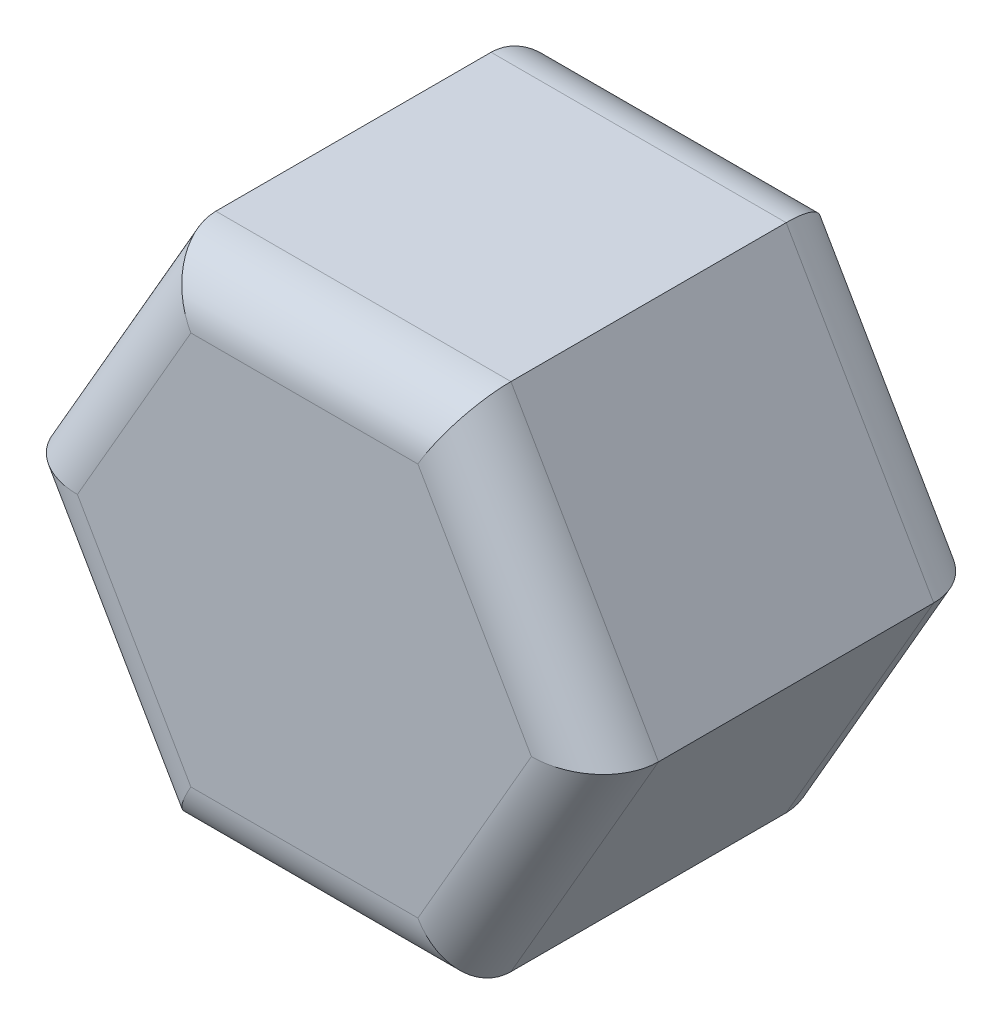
SolidWorks part; units mm, degrees
ref_plane "Спереди" through (0, 0, 0) normal (0, 0, 1) x (1, 0, 0)
ref_plane "Сверху" through (0, 0, 0) normal (0, 1, 0) x (1, 0, 0)
ref_plane "Справа" through (0, 0, 0) normal (1, 0, 0) x (0, 0, -1)
sketch "Эскиз1" plane through (0, 0, 0) normal (0, 0, 1) x (1, 0, 0)
  line L1 (15.0111, 0) -> (7.5056, 13)
  line L2 (7.5056, 13) -> (-7.5056, 13)
  line L3 (-7.5056, 13) -> (-15.0111, 0)
  line L4 (-15.0111, 0) -> (-7.5056, -13)
  line L5 (-7.5056, -13) -> (7.5056, -13)
  line L6 (7.5056, -13) -> (15.0111, 0)
  circle A0 centre (0, 0) radius 13 construction
  dimension "D1" = 26
extrude "Бобышка-Вытянуть1" add sketch "Эскиз1" along normal blind 20
sketch "Эскиз2" plane through (0, 0, 0) normal (0, 0, -1) x (-1, 0, 0)
  circle A0 centre (0, 0) radius 10.25
  dimension "D1" = 20.5
extrude "Вырез-Вытянуть1" cut sketch "Эскиз2" against normal blind 15
fillet "Скругление1" radius 3 12 edges at (0, -13, 20) (-11.2583, -6.5, 20) (-11.2583, 6.5, 20) (0, 13, 20) (11.2583, 6.5, 20) (11.2583, -6.5, 20) (-11.2583, -6.5, 0) (-11.2583, 6.5, 0) (0, -13, 0) (11.2583, -6.5, 0) (11.2583, 6.5, 0) (0, 13, 0)
fillet "Скругление2" radius 1 12 edges at (0.7754, 10.2206, 0.0081) (-10.25, 0, 0) (-9.239, -4.4388, 0.0081) (-5.125, -8.8768, 0) (-0.7754, -10.2206, 0.0081) (5.125, -8.8768, 0) (8.4636, -5.7818, 0.0081) (10.25, 0, 0) (9.239, 4.4388, 0.0081) (-8.4636, 5.7818, 0.0081) (-5.125, 8.8768, 0) (5.125, 8.8768, 0)
